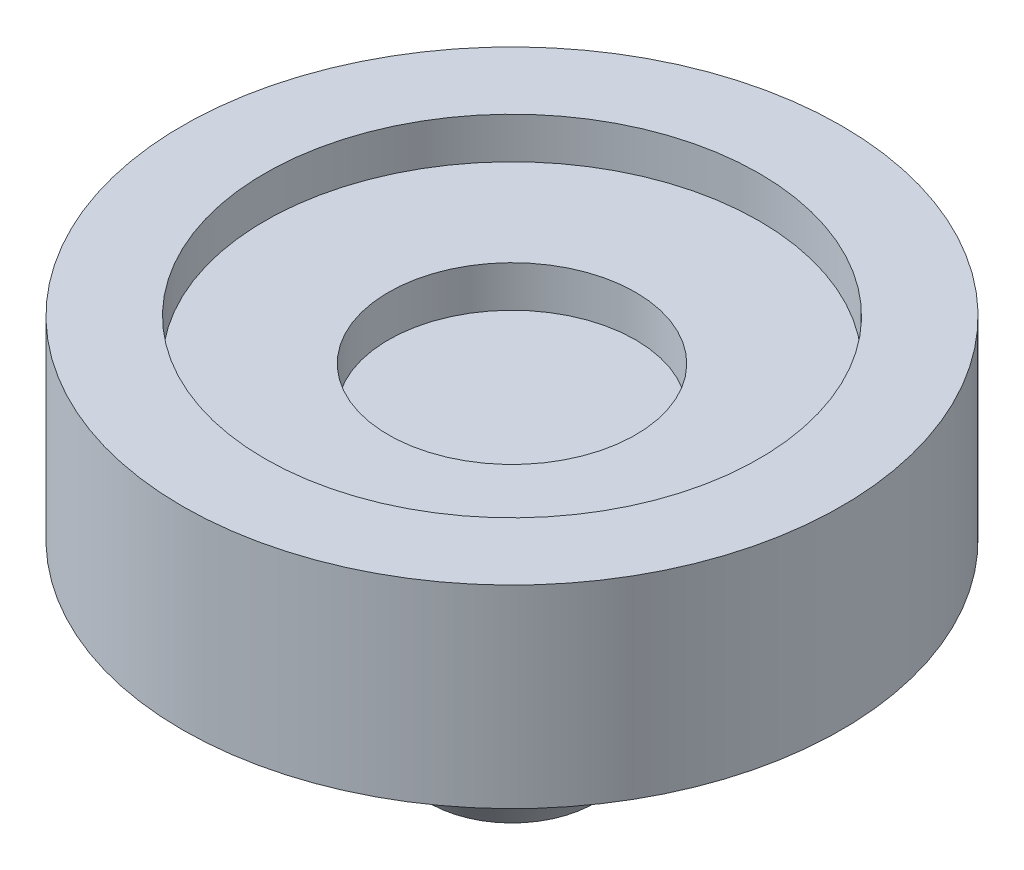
SolidWorks part; units mm, degrees
ref_plane "Plan de face" through (0, 0, 0) normal (0, 0, 1) x (1, 0, 0)
ref_plane "Plan de dessus" through (0, 0, 0) normal (0, 1, 0) x (1, 0, 0)
ref_plane "Plan de droite" through (0, 0, 0) normal (1, 0, 0) x (0, 0, -1)
sketch "Esquisse1" plane through (0, 0, 0) normal (0, 0, 1) x (1, 0, 0)
  line L0 (0, -213.8253) -> (0, 139.1287) construction
  line L6 (0, 0) -> (0, 77)
  line L8 (-50, 50) -> (0, 50) construction
  line L10 (-50, 50) -> (-20, 4.5508)
  line L12 (-8, 0) -> (0, 0)
  line L13 (-50, 50) -> (-80, 50)
  line L14 (-80, 50) -> (-80, 97)
  line L15 (-80, 97) -> (-60, 97)
  line L16 (-60, 97) -> (-60, 87)
  line L17 (-60, 87) -> (-30, 87)
  line L18 (-30, 87) -> (-30, 77)
  line L19 (-30, 77) -> (0, 77)
  arc A1 (-20, 4.5508) -> (-8, 0) centre (0, 39.1918) ccw
  dimension "D2" = 100
  dimension "D3" = 40
  dimension "D4" = 40
  dimension "D1" = 16
  dimension "D5" = 50
  dimension "D6" = 160
  dimension "D7" = 47
  dimension "D8" = 10
  dimension "D9" = 10
  dimension "D10" = 120
  dimension "D11" = 60
revolve "Révolution1" add sketch "Esquisse1" angle 360 about L0
